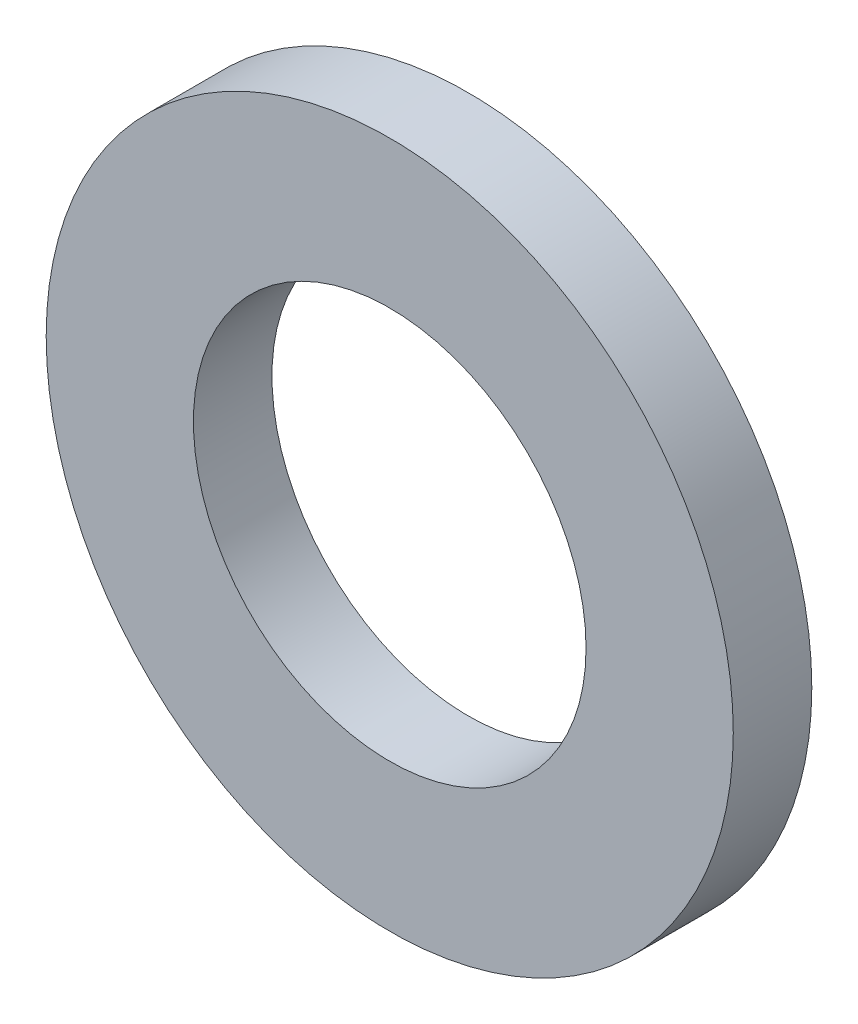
SolidWorks part; units mm, degrees
ref_plane "Plan1" through (0, 0, 0) normal (0, 0, 1) x (1, 0, 0)
ref_plane "Plan2" through (0, 0, 0) normal (0, 1, 0) x (1, 0, 0)
ref_plane "Plan3" through (0, 0, 0) normal (1, 0, 0) x (0, 0, -1)
sketch "Esquisse1" plane through (0, 0, 0) normal (0, 0, 1) x (1, 0, 0)
  circle A0 centre (0, 0) radius 10
  circle A1 centre (0, 0) radius 17.5
  dimension "D1" = 20
  dimension "D2" = 35
extrude "Base-Extrusion" add sketch "Esquisse1" along normal blind 4
